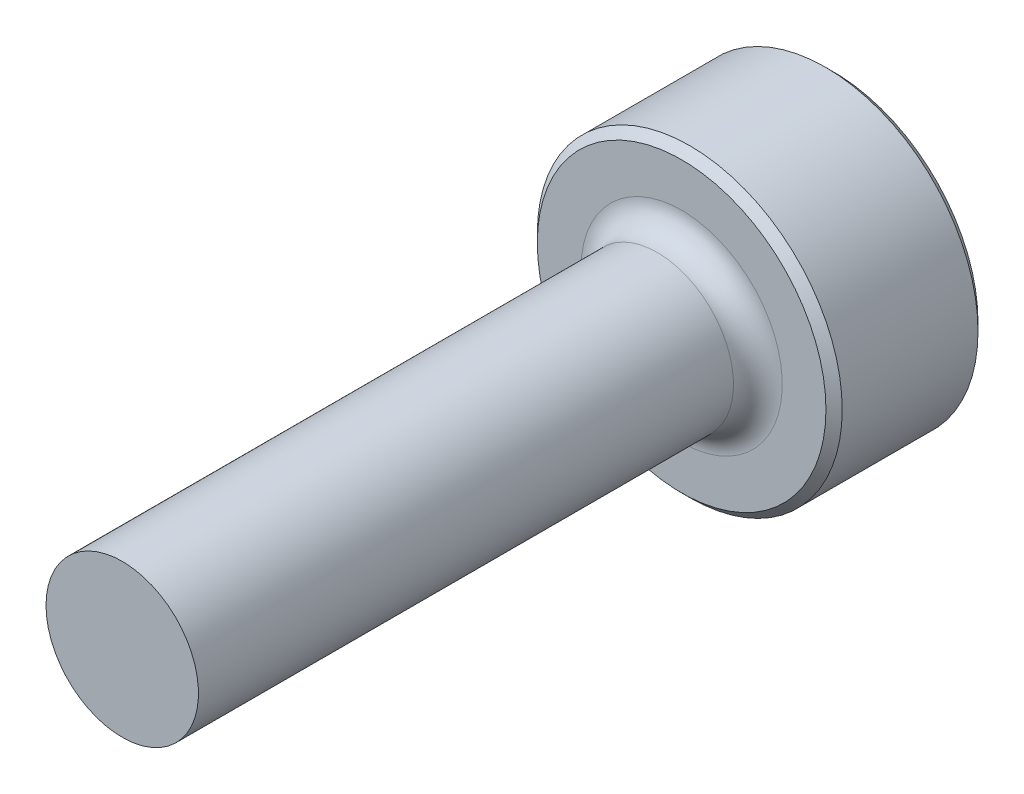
SolidWorks part; units mm, degrees
ref_plane "Front Plane" through (0, 0, 0) normal (0, 0, 1) x (1, 0, 0)
ref_plane "Top Plane" through (0, 0, 0) normal (0, 1, 0) x (1, 0, 0)
ref_plane "Right Plane" through (0, 0, 0) normal (1, 0, 0) x (0, 0, -1)
sketch "Sketch1" plane through (0, 0, 0) normal (1, 0, 0) x (0, 0, -1)
  line L0 (0, 0) -> (0, 4.7625)
  line L1 (0, 4.7625) -> (-4.7498, 4.7625)
  line L2 (-4.7498, 4.7625) -> (-4.7498, 3.1432)
  line L3 (-5.5118, 2.3812) -> (-22.225, 2.3812)
  line L4 (-22.225, 2.3812) -> (-22.225, 0)
  line L5 (-22.225, 0) -> (0, 0)
  line L6 (25.4347, 0) -> (-130.6739, 0) construction
  arc A0 (-4.7498, 3.1432) -> (-5.5118, 2.3812) centre (-5.5118, 3.1432) cw
  dimension "D4" = 0.762
  dimension "D1" = 4.7625
  dimension "D2" = 9.525
  dimension "D3" = 4.7498
  dimension "D5" = 22.225
revolve "Revolve1" add sketch "Sketch1" angle 360 about L6
chamfer "Chamfer1" distance 0.254 angle 45 2 edges at (-4.7625, 0, 0) (-4.7625, 0, 4.7498)
